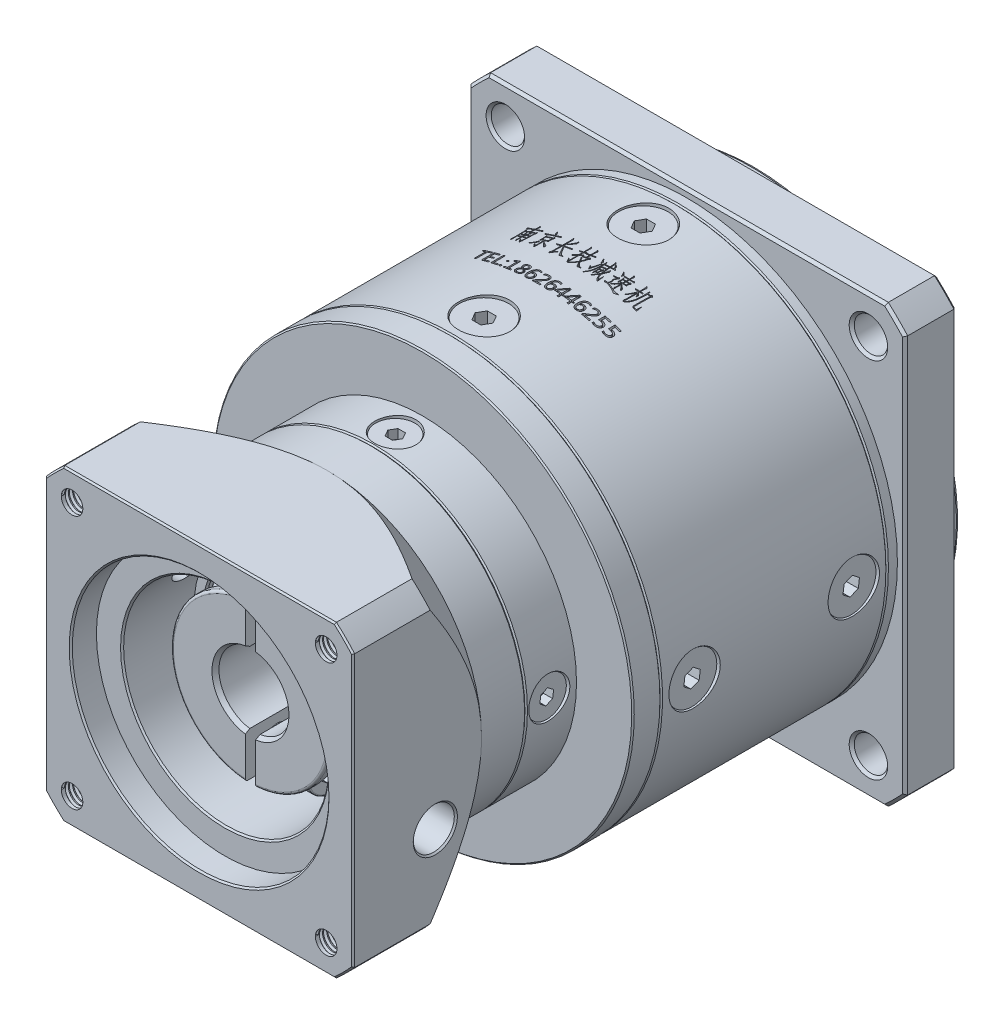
SolidWorks part; units mm, degrees
ref_plane "前视基准面" through (0, 0, 0) normal (0, 0, 1) x (1, 0, 0)
ref_plane "上视基准面" through (0, 0, 0) normal (0, 1, 0) x (1, 0, 0)
ref_plane "右视基准面" through (0, 0, 0) normal (1, 0, 0) x (0, 0, -1)
imported_body "14-50-70-M5-1-solid1"
imported_body "14-50-70-M5-1-solid2"
imported_body "14-50-70-M5-1-solid3"
imported_body "14-50-70-M5-1-solid4"
imported_body "14-50-70-M5-1-solid5"
imported_body "ZF80-K15-L2-F60-7-solid1"
imported_body "ZF80-K15-L2-F60-7-solid2"
imported_body "ZF80-K15-L2-F60-7-solid3"
imported_body "ZF80-K15-L2-F60-7-solid4"
imported_body "ZF80-K15-L2-F60-7-solid5"
imported_body "ZF80-K15-L2-F60-7-solid6"
imported_body "ZF80-K15-L2-F60-7-solid7"
imported_body "ZF80-K15-L2-F60-7-solid8"
imported_body "ZF80-K15-L2-F60-7-solid9"
imported_body "ZF80-K15-L2-F60-7-solid10"
imported_body "ZF80-K15-L2-F60-7-solid11"
imported_body "ZF80-K15-L2-F60-7-solid12"
imported_body "ZF80-K15-L2-F60-7-solid13"
sketch "草图1" plane through (0, 0, -46.6459) normal (0, 0, -1) x (-1, 0, 0)
  circle A0 centre (65.6197, 20.4796) radius 10.8524
  dimension "D1" = 21.7048
extrude "凸台-拉伸1" add sketch "草图1" along normal blind 5
